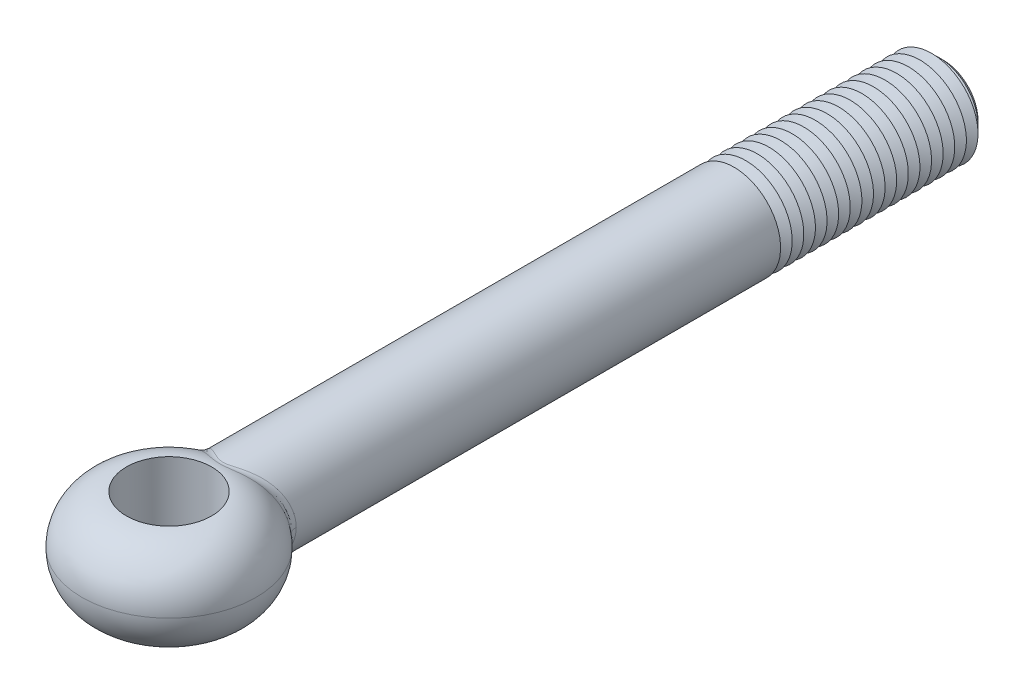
SolidWorks part; units mm, degrees
ref_plane "Front Plane" through (0, 0, 0) normal (0, 0, 1) x (1, 0, 0)
ref_plane "Top Plane" through (0, 0, 0) normal (0, 1, 0) x (1, 0, 0)
ref_plane "Right Plane" through (0, 0, 0) normal (1, 0, 0) x (0, 0, -1)
sketch "Sketch7" plane through (0, 0, 0) normal (0, 1, 0) x (1, 0, 0)
  circle A0 centre (0, 0) radius 22.5
  dimension "D1" = 45
extrude "Boss-Extrude3" add sketch "Sketch7" along normal mid plane 25
sketch "Sketch8" plane through (0, 0, 0) normal (0, 0, 1) x (1, 0, 0)
  circle A0 centre (0, 0) radius 12
  dimension "D1" = 24
extrude "Boss-Extrude4" add sketch "Sketch8" against normal blind 200
fillet "Fillet5" radius 12.5 2 edges at (0, -12.5, 22.5) (0, 12.5, 22.5)
fillet "Fillet6" radius 3.5 2 edges at (0.1915, -11.9985, -13.5039) (-0.1915, 11.9985, -13.5039)
chamfer "Chamfer1" distance 3 angle 45 1 edges at (12, 0, -200)
sketch "Sketch10" plane through (0, 0, 0) normal (0, 1, 0) x (1, 0, 0)
  line L0 (0, 28.1405) -> (0, -7.9233) construction
sketch "Sketch11" plane through (0, 0, 0) normal (0, 1, 0) x (1, 0, 0)
  line L0 (-12, 146) -> (-9.4019, 147.5)
  line L1 (-12, 197) -> (-12, 20.8746) construction
  line L2 (-9.4019, 147.5) -> (-12, 149)
  line L3 (-12, 149) -> (-12, 146)
  line L4 (9, 200) -> (-9, 200) construction
  dimension "D1" = 3
  dimension "D2" = 54
revolve "Cut-Revolve1" cut sketch "Sketch11" angle 360 about L0
pattern_linear "LPattern1" count 18 spacing 3 along (0, 0, -1) of "Cut-Revolve1"
sketch "Sketch12" plane through (0, 0, 0) normal (0, 1, 0) x (1, 0, 0)
  circle A0 centre (0, 0) radius 11
  dimension "D1" = 22
extrude "Cut-Extrude1" cut sketch "Sketch12" against normal mid plane 25
